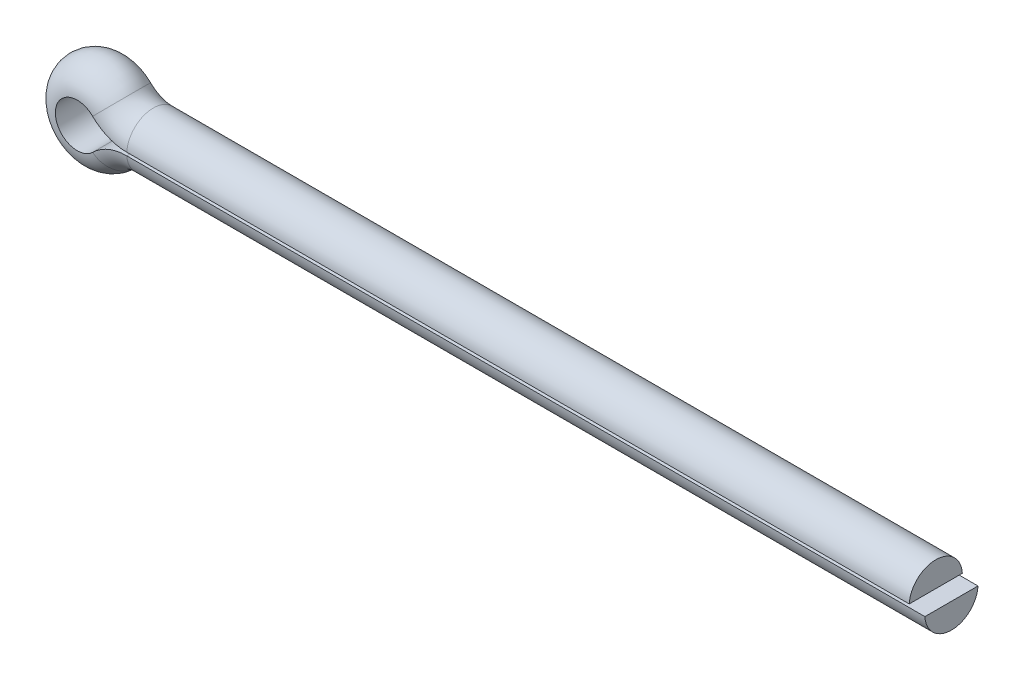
SolidWorks part; units mm, degrees
ref_plane "Front Plane" through (0, 0, 0) normal (0, 0, 1) x (1, 0, 0)
ref_plane "Top Plane" through (0, 0, 0) normal (0, 1, 0) x (1, 0, 0)
ref_plane "Right Plane" through (0, 0, 0) normal (1, 0, 0) x (0, 0, -1)
sketch "PathSke" plane through (0, 0, 0) normal (0, 0, 1) x (1, 0, 0)
  line L0 (12.7, 0) -> (0, 0) construction
  line L1 (0, 0) -> (0, 3.3765) construction
  line L2 (0, -0.4742) -> (0, 0.4742) construction
  line L3 (12.954, -0.4318) -> (0, -0.4318)
  line L4 (0, 0.4318) -> (12.7, 0.4318)
  line L5 (-1.5656, 0) -> (-1.5656, 3.3765) construction
  line L6 (0.4742, 0) -> (-0.4742, 0) construction
  arc A0 (0, -0.4318) -> (-0.2679, -0.5419) centre (0, -0.8128) ccw
  arc A1 (-0.2679, -0.5419) -> (-0.2679, 0.5419) centre (-0.8036, 0) cw
  arc A2 (-0.2679, 0.5419) -> (0, 0.4318) centre (0, 0.8128) ccw
ref_plane "Plane1" through (12.7, 0, 0) normal (1, 0, 0) x (0, 0, -1)
sketch "Sketch2" plane through (12.7, 0, 0) normal (1, 0, 0) x (0, 0, -1)
  line L0 (-0.4311, 0.0254) -> (0.4311, 0.0254)
  arc A0 (0.4311, 0.0254) -> (-0.4311, 0.0254) centre (0, 0) ccw
sweep "Sweep1" add profiles "Sketch2" path "PathSke"
equation "\"D2@PathSke\"=\"Head_dia@PathSke\"/4"
equation "\"D1@Sketch2\"=\"Diameter@PathSke\""
